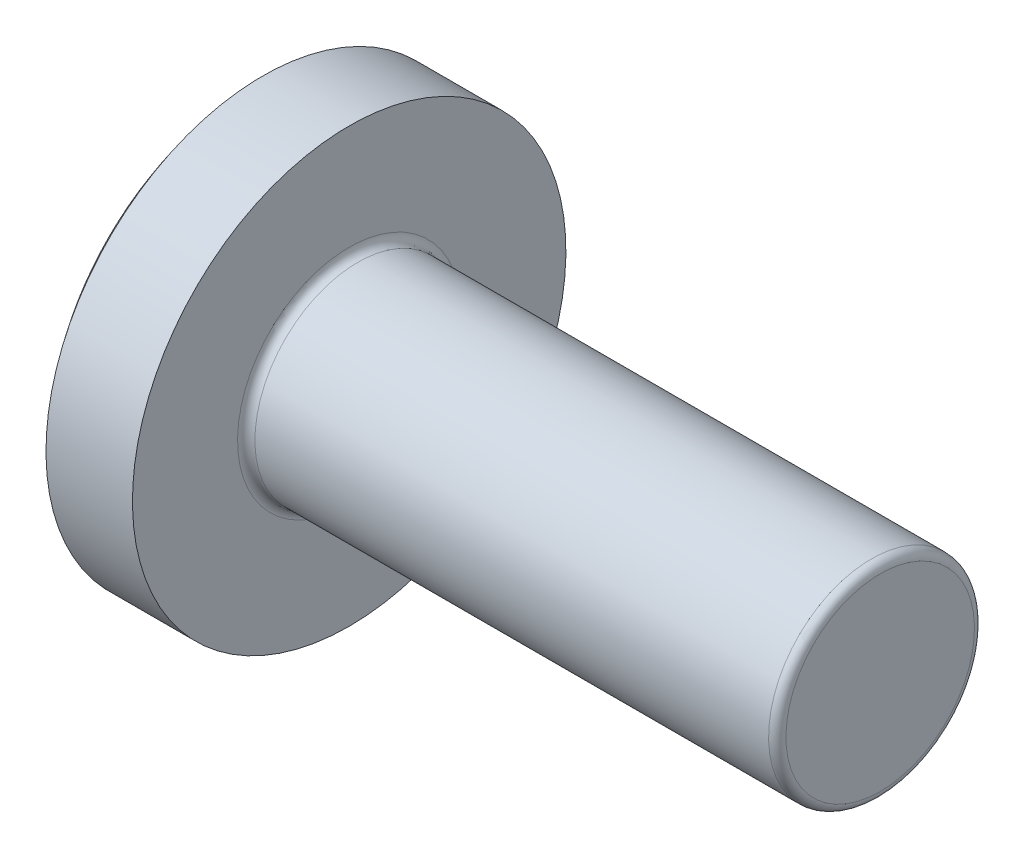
SolidWorks part; units mm, degrees
ref_plane "Front" through (0, 0, 0) normal (0, 0, 1) x (1, 0, 0)
ref_plane "Top" through (0, 0, 0) normal (0, 1, 0) x (1, 0, 0)
ref_plane "Right" through (0, 0, 0) normal (1, 0, 0) x (0, 0, -1)
sketch "Sketch1" plane through (0, 0, 0) normal (0, 0, 1) x (1, 0, 0)
  line L0 (-8.6356, 0) -> (8.9, 0) construction
  line L1 (32, 0) -> (32, 4.75)
  line L2 (32, 4.75) -> (7.5, 4.75)
  line L3 (7.5, 4.75) -> (7.5, 10)
  line L4 (7.5, 10) -> (3.51, 10)
  line L5 (32, 0) -> (0, 0)
  arc A0 (3.51, 10) -> (0, 0) centre (16, 0) ccw
  dimension "rf" = 16
  dimension "st" = 9.5
  dimension "k" = 7.5
  dimension "l" = 24.5
  dimension "dk" = 20
  dimension "a" = 1.4
revolve "Base" add sketch "Sketch1" angle 360 about L0
sketch "Sketch2" plane through (0, 0, 0) normal (1, 0, 0) x (0, 0, -1)
  line L0 (6.5369, 0) -> (-7.0008, 0) construction
  line L1 (0, 6.811) -> (0, -6.4314) construction
  line L2 (-1.01, 5.05) -> (1.01, 5.05)
  line L3 (1.01, 5.05) -> (1.01, 1.01)
  line L4 (1.01, 1.01) -> (5.05, 1.01)
  line L5 (5.05, 1.01) -> (5.05, -1.01)
  line L6 (1.01, -1.01) -> (5.05, -1.01)
  line L7 (1.01, -5.05) -> (1.01, -1.01)
  line L8 (-1.01, -5.05) -> (1.01, -5.05)
  line L9 (-1.01, -5.05) -> (-1.01, -1.01)
  line L10 (-1.01, -1.01) -> (-5.05, -1.01)
  line L11 (-5.05, 1.01) -> (-5.05, -1.01)
  line L12 (-1.01, 1.01) -> (-5.05, 1.01)
  line L13 (-1.01, 5.05) -> (-1.01, 1.01)
  point P5 (-5.05, 0)
  point P11 (5.05, 0)
  point P15 (0, -5.05)
  point P20 (0, 5.05)
  dimension "m" = 10.1
  dimension "D2" = 10.1
  dimension "D3" = 2.02
  dimension "D4" = 2.02
extrude "Cut-Extrude1" cut sketch "Sketch2" along normal blind 5.2
fillet "Fillet1" radius 0.4 2 edges at (7.5, -4.75, 0) (32, -4.75, 0)
draft "Draft1" type of draft neutral plane draft angle 30 neutral plane "Right" faces to draft 4 parameters "D1"=30
sketch "Sketch3" plane through (0, 0, 0) normal (0, 0, 1) x (1, 0, 0)
  line L0 (8.425, 5.7) -> (9.375, 5.7)
  line L1 (9.375, 5.7) -> (9.375, 4.75)
  line L2 (9.375, 4.75) -> (8.9, 3.9273)
  line L3 (8.9, 3.9273) -> (8.425, 4.75)
  line L4 (8.425, 4.75) -> (8.425, 5.7)
  line L5 (0, 0) -> (33.8691, 0) construction
  line L6 (7.5, -10) -> (7.5, 10) construction
  dimension "D1" = 9.5
  dimension "D2" = 0.95
  dimension "D3" = 1.4
revolve "Cut-Revolve10" [suppressed] cut sketch "Sketch3" angle 360 about L5
pattern_linear "LPattern10" [suppressed] count 20 spacing 1.14 along (1, 0, 0)
equation "\"D3@Sketch2\" = \"m@Sketch2\" / 5"
equation "\"D4@Sketch2\" = \"D3@Sketch2\""
equation "\"D2@Sketch2\" = \"m@Sketch2\""
equation "\"D2@ThreadCosmetic1\" = \"st@Sketch1\"  * 4 / 5"
equation "\"D1@ThreadCosmetic1\" = \"l@Sketch1\" - \"a@Sketch1\""
equation "\"D1@Sketch3\" = \"st@Sketch1\""
equation "\"D2@Sketch3\" = (  \"st@Sketch1\" - \"D2@ThreadCosmetic1\" )  / 2"
equation "\"D3@Sketch3\" = \"a@Sketch1\""
equation "\"D3@LPattern10\" = \"D2@Sketch3\" * 1.2"
equation "\"D1@LPattern10\" = \"D1@ThreadCosmetic1\" / \"D3@LPattern10\""
